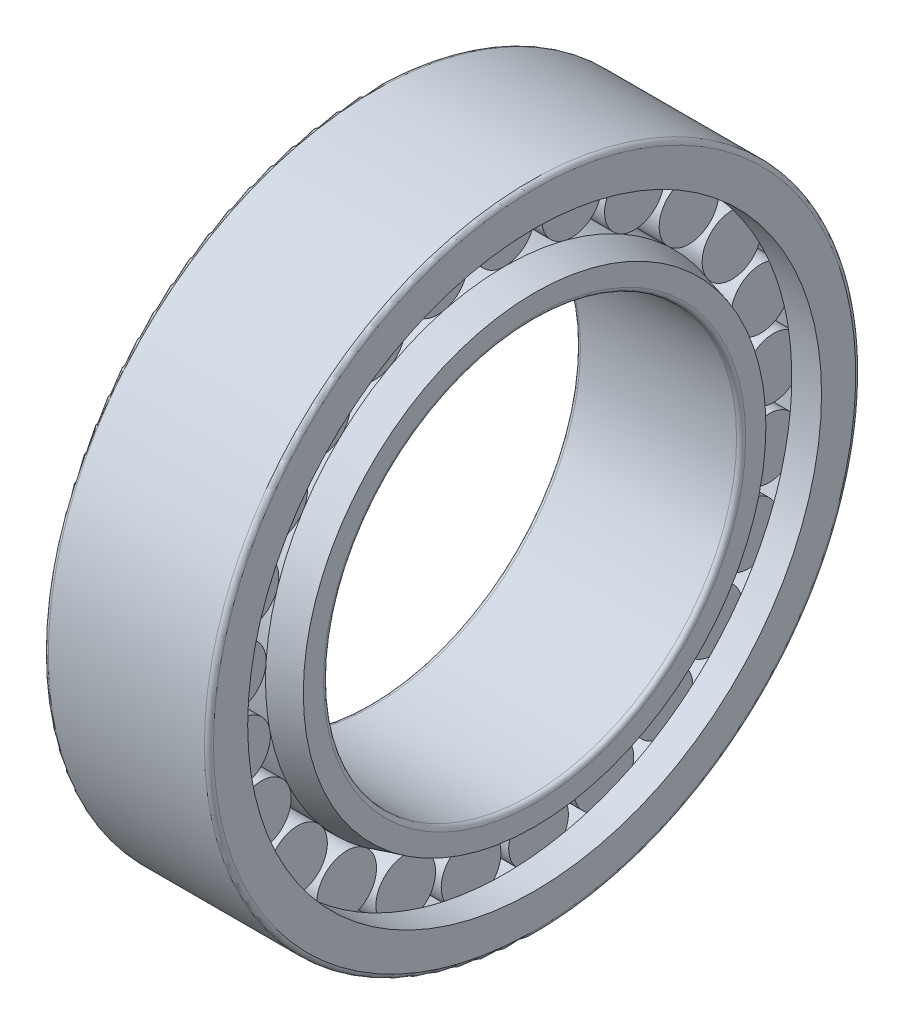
SolidWorks part; units mm, degrees
ref_plane "Front" through (0, 0, 0) normal (0, 0, 1) x (1, 0, 0)
ref_plane "Top" through (0, 0, 0) normal (0, 1, 0) x (1, 0, 0)
ref_plane "Right" through (0, 0, 0) normal (1, 0, 0) x (0, 0, -1)
sketch "Sketch1" plane through (0, 0, 0) normal (0, 0, 1) x (1, 0, 0)
  line L0 (0, 44.0554) -> (0, 70.0073) construction
  line L1 (75.4578, 78.8484) -> (0, 78.8484) construction
  line L2 (78.3629, -78.8484) -> (0, -78.8484) construction
  line L7 (12.7879, 57.9333) -> (20, 56.0008)
  line L8 (-12.7879, 57.9333) -> (12.7879, 57.9333)
  line L9 (-12.7879, 57.9333) -> (-20, 56.0008)
  line L12 (0, 0) -> (78.3067, 0) construction
  line L13 (20, 51.1) -> (20, 56.0008)
  line L14 (-18.9, 50) -> (18.9, 50)
  line L15 (-20, 51.1) -> (-20, 56.0008)
  arc A2 (18.9, 50) -> (20, 51.1) centre (18.9, 51.1) ccw
  arc A3 (-20, 51.1) -> (-18.9, 50) centre (-18.9, 51.1) ccw
  dimension "D1" = 1.1
  dimension "D2" = 40
  dimension "D3" = 15
  dimension "D4" = 100
  dimension "D5" = 115.8666
  dimension "D6" = 7.2121
  dimension "D7" = 157.6968
revolve "Revolve1" add sketch "Sketch1" angle 360 about L12
sketch "Sketch2" plane through (0, 0, 0) normal (0, 0, 1) x (1, 0, 0)
  line L0 (5.4091, 65.1454) -> (-5.4091, 65.1454) construction
  line L2 (12.7879, 57.9333) -> (-12.7879, 57.9333) construction
  line L5 (12.7879, 65.1454) -> (12.7879, 72.3775)
  line L7 (5.4091, 65.1454) -> (5.4091, 72.3775)
  line L8 (5.4091, 72.3775) -> (12.7879, 72.3775)
  line L9 (5.4091, 65.1454) -> (12.7879, 65.1454)
  line L10 (0, 71.4038) -> (0, 54.1434) construction
  line L12 (-12.7879, 65.1454) -> (-12.7879, 72.3775)
  line L13 (-5.4091, 65.1454) -> (-12.7879, 65.1454)
  line L14 (-5.4091, 65.1454) -> (-5.4091, 72.3775)
  line L15 (-5.4091, 72.3775) -> (-12.7879, 72.3775)
  dimension "D1" = 14.4442
  dimension "D2" = 7.2321
  dimension "D3" = 10.8182
  dimension "D4" = 25.5758
revolve "Revolve2" add sketch "Sketch2" angle 360 about L0
sketch "Sketch3" plane through (0, 0, 0) normal (0, 0, 1) x (1, 0, 0)
  line L3 (0, 59.3178) -> (0, 74.7165) construction
  line L4 (-20, 69.4727) -> (-12.7879, 69.4727)
  line L5 (20, 69.4727) -> (20, 77.7484)
  line L6 (-20, 69.4727) -> (-20, 77.7484)
  line L14 (12.7879, 69.4727) -> (12.7879, 72.3575)
  line L15 (12.7879, 72.3575) -> (5.4091, 72.3575)
  line L16 (5.4091, 69.4727) -> (5.4091, 72.3575)
  line L17 (-5.4091, 69.4727) -> (-5.4091, 72.3575)
  line L18 (-12.7879, 69.4727) -> (-12.7879, 72.3575)
  line L19 (-12.7879, 72.3575) -> (-5.4091, 72.3575)
  line L20 (-5.4091, 69.4727) -> (5.4091, 69.4727)
  line L21 (12.7879, 69.4727) -> (20, 69.4727)
  line L22 (0, 0) -> (94.5773, 0) construction
  line L23 (-18.9, 78.8484) -> (18.9, 78.8484)
  arc A2 (20, 77.7484) -> (18.9, 78.8484) centre (18.9, 77.7484) ccw
  arc A3 (-18.9, 78.8484) -> (-20, 77.7484) centre (-18.9, 77.7484) ccw
  dimension "D5" = 1.1
  dimension "D1" = 10.8182
  dimension "D2" = 2.8848
  dimension "D3" = 7.2121
  dimension "D4" = 40
  dimension "D6" = 157.6968
  dimension "D7" = 138.9454
revolve "Revolve3" add sketch "Sketch3" angle 360 about L22
pattern_circular "Circular-Pattern1" count 25 over 360 about axis through (0, 0, 0) along (1, 0, 0) of "Revolve2"
equation "\"D5@Sketch1\"=\"D4@Sketch1\"+11*( \"D7@Sketch1\"-\"D4@Sketch1\")/40"
equation "\"D6@Sketch1\"=( \"D7@Sketch1\"-\"D4@Sketch1\")/8"
equation "\"D1@Sketch2\"=( \"D7@Sketch1\"-\"D4@Sketch1\")/4+0.02"
equation "\"D2@Sketch2\"=(\"D1@Sketch2\"+0.02)/2"
equation "\"D3@Sketch2\"=( \"D7@Sketch1\"-\"D4@Sketch1\")*0.1875"
equation "\"D4@Sketch2\"=\"D2@Sketch1\"-\"D6@Sketch1\"*2"
equation "\"D1@Sketch3\"=\"D3@Sketch2\""
equation "\"D2@Sketch3\"=( \"D7@Sketch1\"-\"D4@Sketch1\")/20"
equation "\"D3@Sketch3\"=\"D6@Sketch1\""
equation "\"D4@Sketch3\"=\"D2@Sketch1\""
equation "\"D5@Sketch3\"=\"D1@Sketch1\""
equation "\"D6@Sketch3\" = \"D7@Sketch1\""
equation "\"D7@Sketch3\"=\"D5@Sketch1\"+(( \"D7@Sketch1\"-\"D4@Sketch1\")/4-\"D2@Sketch3\")*2"
equation "\"D1@Circular-Pattern1\" = int( 3.14159265 / atn(( ( \"D7@Sketch1\"-\"D4@Sketch1\") / 8) / sqr( ( \"D7@Sketch1\"+\"D4@Sketch1\") * ( \"D7@Sketch1\"+\"D4@Sketch1\")/16- ( ( \"D7@Sketch1\"-\"D4@Sketch1\")/8) *  ( ( \"D7@S"
